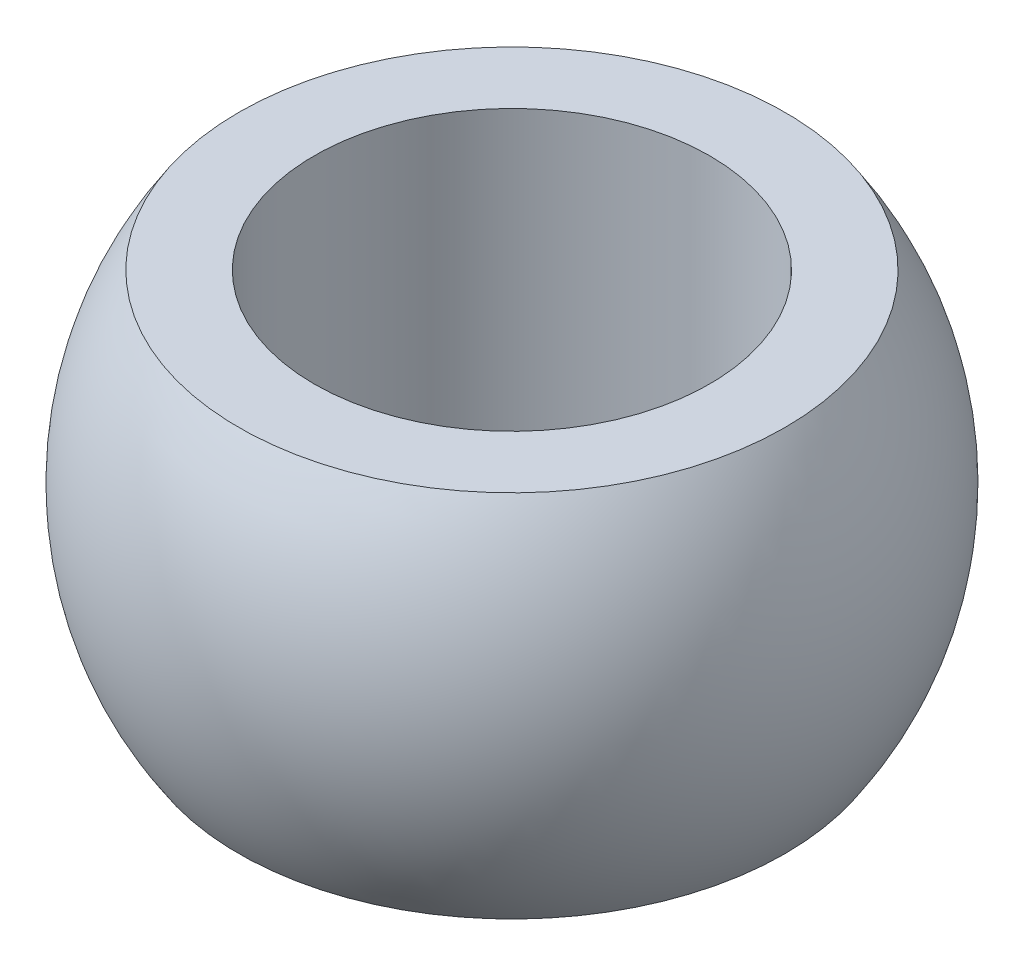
SolidWorks part; units mm, degrees
ref_plane "Plan1" through (0, 0, 0) normal (0, 0, 1) x (1, 0, 0)
ref_plane "Plan2" through (0, 0, 0) normal (0, 1, 0) x (1, 0, 0)
ref_plane "Plan3" through (0, 0, 0) normal (1, 0, 0) x (0, 0, -1)
sketch "Esquisse1" plane through (0, 0, 0) normal (0, 0, 1) x (1, 0, 0)
  line L0 (10.3562, 7) -> (7.5, 7)
  line L1 (7.5, 7) -> (7.5, -7)
  line L2 (7.5, -7) -> (10.3562, -7)
  line L3 (0, 10.3803) -> (0, -10.3803) construction
  line L4 (50, 0) -> (-50, 0) construction
  arc A0 (10.3562, 7) -> (10.3562, -7) centre (0, 0) cw
  point P8 (7.5, 0)
  dimension "D1" = 12.5
  dimension "D2" = 15
  dimension "D3" = 14
revolve "Base-Révolution" add sketch "Esquisse1" angle 360 about L3
